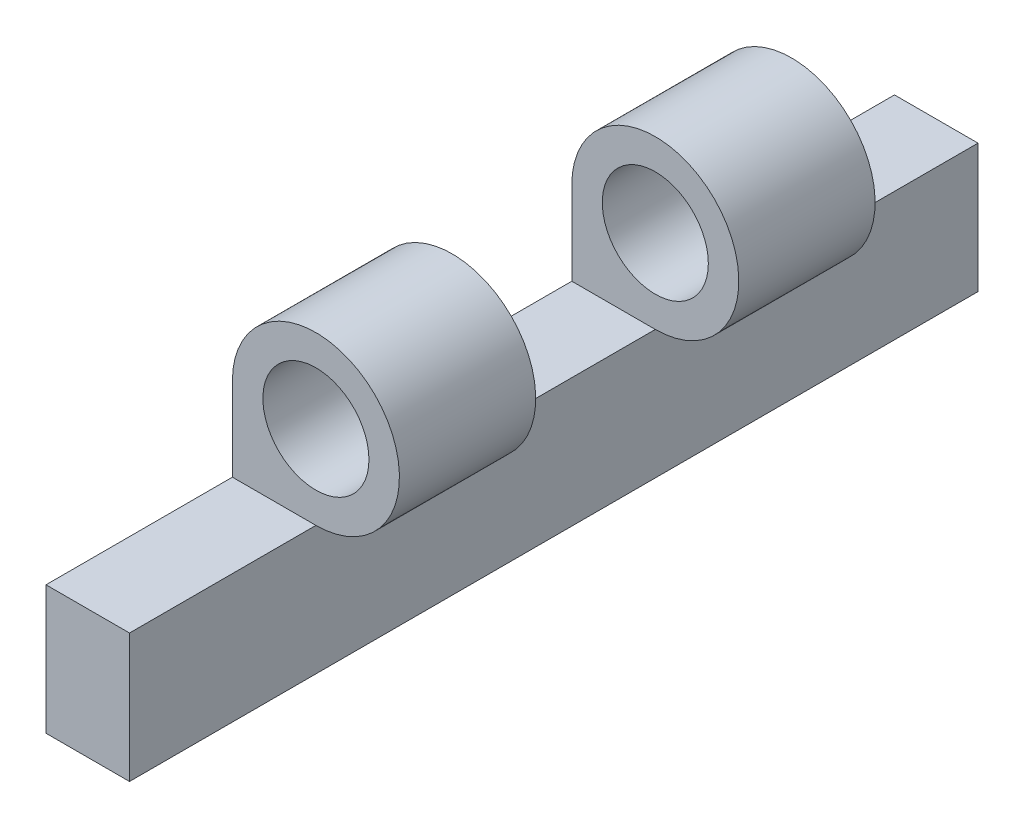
SolidWorks part; units mm, degrees
ref_plane "Front" through (0, 0, 0) normal (0, 0, 1) x (1, 0, 0)
ref_plane "Top" through (0, 0, 0) normal (0, 1, 0) x (1, 0, 0)
ref_plane "Right" through (0, 0, 0) normal (1, 0, 0) x (0, 0, -1)
sketch "Sketch1" plane through (0, 0, 0) normal (0, 0, 1) x (1, 0, 0)
  line L0 (0, 0) -> (0, 12.7)
  dimension "D1" = 12.7
extrude "Extrude-Thin1" add sketch "Sketch1" along normal mid plane 50.8 thin
sketch "Sketch2" plane through (0, 0, 25.4) normal (0, 0, 1) x (1, 0, 0)
  circle A0 centre (5, 12.7) radius 5
sweep "Sweep1" add profiles "Sketch2"
sketch "Sketch3" plane through (0, 0, 25.4) normal (0, 0, 1) x (1, 0, 0)
  circle A0 centre (5, 12.7) radius 3.175
  dimension "D1" = 6.35
extrude "Cut-Extrude1" cut sketch "Sketch3" against normal through all
sketch "Layout for cuts" plane through (5, 0, 0) normal (1, 0, 0) x (0, 0, -1)
  line L1 (25.4, 7.7) -> (25.4, 17.7) construction
  line L2 (-25.4, 6.7) -> (25.4, 6.7)
  line L3 (-25.4, 6.7) -> (25.4, 6.7)
  line L4 (-25.4, 17.7) -> (-25.4, 7.7) construction
  line L5 (25.4, 6.7) -> (25.4, 17.7)
  line L6 (-25.4, 17.7) -> (-25.4, 6.7)
  line L7 (-25.4, 17.7) -> (25.4, 17.7)
  line L8 (-15.24, 17.7) -> (-15.24, 6.7)
  line L9 (-5.08, 17.7) -> (-5.08, 6.7)
  line L10 (0, 107.8047) -> (0, 0) construction
  line L11 (5.08, 17.7) -> (5.08, 6.7)
  line L12 (15.24, 17.7) -> (15.24, 6.7)
sketch "Sketch10" plane through (5, 0, 0) normal (1, 0, 0) x (0, 0, -1)
  line L0 (-25.4, 6.7) -> (25.4, 6.7) construction
  line L2 (-25.4, 17.7) -> (25.4, 17.7) construction
  line L4 (-16.24, 6.7) -> (-4.08, 6.7)
  line L6 (-16.24, 17.7) -> (-4.08, 17.7)
  line L8 (4.08, 6.7) -> (16.24, 6.7)
  line L9 (4.08, 17.7) -> (16.24, 17.7)
  line L10 (-16.24, 17.7) -> (-16.24, 6.7)
  line L11 (-16.24, 17.7) -> (-16.24, 6.7)
  line L13 (16.24, 17.7) -> (16.24, 6.7)
  line L14 (16.24, 17.7) -> (16.24, 6.7)
  line L16 (-4.08, 17.7) -> (-4.08, 6.7)
  line L17 (-4.08, 17.7) -> (-4.08, 6.7)
  line L19 (4.08, 17.7) -> (4.08, 6.7)
  line L20 (4.08, 17.7) -> (4.08, 6.7)
  dimension "D1" = 1
  dimension "D2" = 1
  dimension "D3" = 1
  dimension "D4" = 1
extrude "2Cuts" [suppressed] cut sketch "Sketch10" against normal through all and the other way through all
sketch "Sketch7" plane through (5, 0, 0) normal (1, 0, 0) x (0, 0, -1)
  line L0 (-25.4, 6.7) -> (25.4, 6.7) construction
  line L1 (25.4, 6.7) -> (25.4, 17.7) construction
  line L2 (-25.4, 17.7) -> (25.4, 17.7) construction
  line L3 (-25.4, 17.7) -> (-25.4, 6.7) construction
  line L4 (25.4, 7.7) -> (-25.4, 7.7)
  line L5 (-25.4, 7.7) -> (-25.4, 0)
  line L6 (-25.4, 0) -> (25.4, 0)
  line L7 (25.4, 0) -> (25.4, 7.7)
  line L8 (25.4, 7.7) -> (-25.4, 7.7)
  line L9 (-25.4, 7.7) -> (-25.4, 0)
  line L10 (-25.4, 0) -> (25.4, 0)
  line L11 (25.4, 0) -> (25.4, 7.7)
  line L12 (-25.4, 6.7) -> (-14.24, 6.7)
  line L13 (25.4, 6.7) -> (25.4, 17.7)
  line L14 (-25.4, 17.7) -> (-14.24, 17.7)
  line L15 (-25.4, 17.7) -> (-25.4, 6.7)
  line L18 (-14.24, 17.7) -> (-14.24, 6.7)
  line L19 (-14.24, 17.7) -> (-14.24, 6.7)
  line L21 (14.24, 17.7) -> (14.24, 6.7)
  line L22 (14.24, 17.7) -> (14.24, 6.7)
  line L24 (-6.08, 17.7) -> (-6.08, 6.7)
  line L25 (-6.08, 17.7) -> (-6.08, 6.7)
  line L26 (-6.08, 17.7) -> (6.08, 17.7)
  line L27 (6.08, 17.7) -> (6.08, 6.7)
  line L28 (6.08, 17.7) -> (6.08, 6.7)
  line L29 (-6.08, 6.7) -> (6.08, 6.7)
  line L30 (14.24, 6.7) -> (25.4, 6.7)
  line L31 (14.24, 17.7) -> (25.4, 17.7)
  dimension "D1" = 0
  dimension "D2" = 1
  dimension "D3" = 1
  dimension "D4" = 1
  dimension "D5" = 1
extrude "3Cuts" cut sketch "Sketch7" against normal through all and the other way through all contours L19 L14 L15 L8 | L28 L26 L25 M13 | L31 L22 L13 M13
equation "\"D2@Layout for cuts\"= \"D1@Extrude-Thin1\" / 5"
equation "\"D3@Layout for cuts\"= \"D1@Extrude-Thin1\" / 5"
